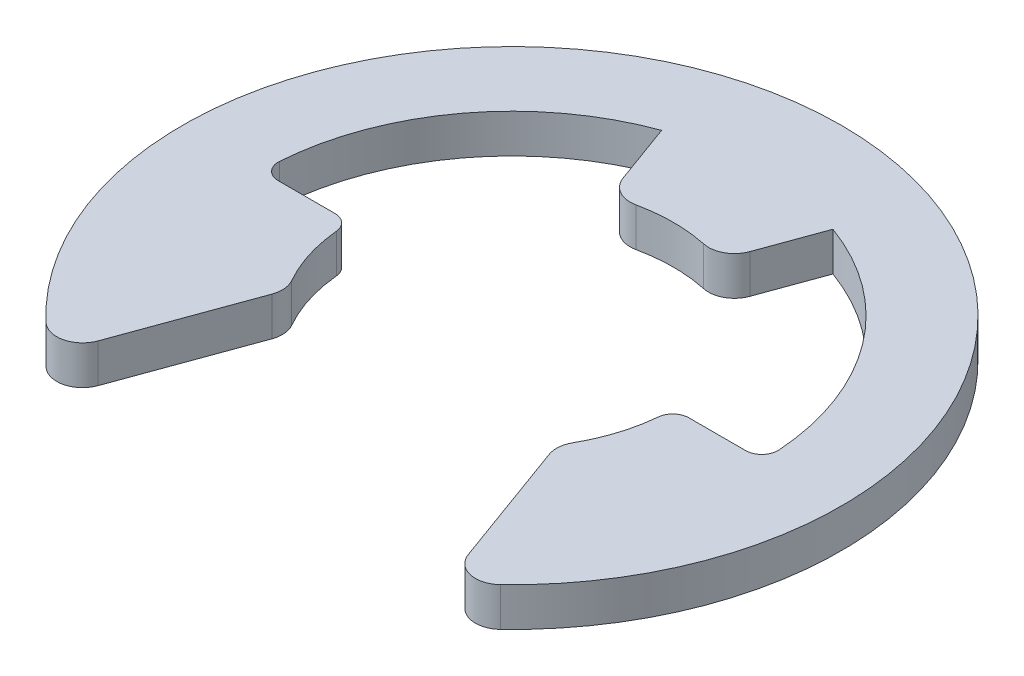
SolidWorks part; units mm, degrees
ref_plane "Front Plane" through (0, 0, 0) normal (0, 0, 1) x (1, 0, 0)
ref_plane "Top Plane" through (0, 0, 0) normal (0, 1, 0) x (1, 0, 0)
ref_plane "Right Plane" through (0, 0, 0) normal (1, 0, 0) x (0, 0, -1)
sketch "Sketch2" plane through (0, 0, 0) normal (0, 1, 0) x (1, 0, 0)
  line L0 (-6.1203, -8.1598) -> (-4.16, -2.7739)
  line L2 (4.16, -2.7739) -> (6.1203, -8.1598)
  line L4 (-5, 0) -> (-7.75, 0)
  line L5 (5, 0) -> (7.75, 0)
  line L6 (-2.6507, 7.2826) -> (-1.7101, 4.6985)
  line L8 (1.7101, 4.6985) -> (2.6507, 7.2826)
  arc A0 (6.1203, -8.1598) -> (-6.1203, -8.1598) centre (0, 0) ccw
  arc A1 (4.16, -2.7739) -> (5, 0) centre (0, 0) ccw
  arc A2 (7.75, 0) -> (2.6507, 7.2826) centre (0, 0) ccw
  arc A3 (-5, 0) -> (-4.16, -2.7739) centre (0, 0) ccw
  arc A4 (1.7101, 4.6985) -> (-1.7101, 4.6985) centre (0, 0) ccw
  arc A5 (-2.6507, 7.2826) -> (-7.75, 0) centre (0, 0) ccw
  point P15 (0, 0)
  point P16 (0, 5)
  dimension "D1" = 20.4
  dimension "D2" = 10
  dimension "D3" = 15.5
  dimension "D4" = 70
  dimension "D5" = 70
  dimension "D6" = 8.32
  dimension "D7" = 40
extrude "Boss-Extrude1" add sketch "Sketch2" along normal mid plane 1.2
fillet "Fillet1" radius 0.8 6 edges at (4.16, 0, 2.7739) (-4.16, 0, 2.7739) (1.7101, 0, -4.6985) (-1.7101, 0, -4.6985) (6.1203, 0, 8.1598) (-6.1203, 0, 8.1598)
fillet "Fillet2" radius 0.5 4 edges at (7.75, 0, 0) (5, 0, 0) (-7.75, 0, 0) (-5, 0, 0)
